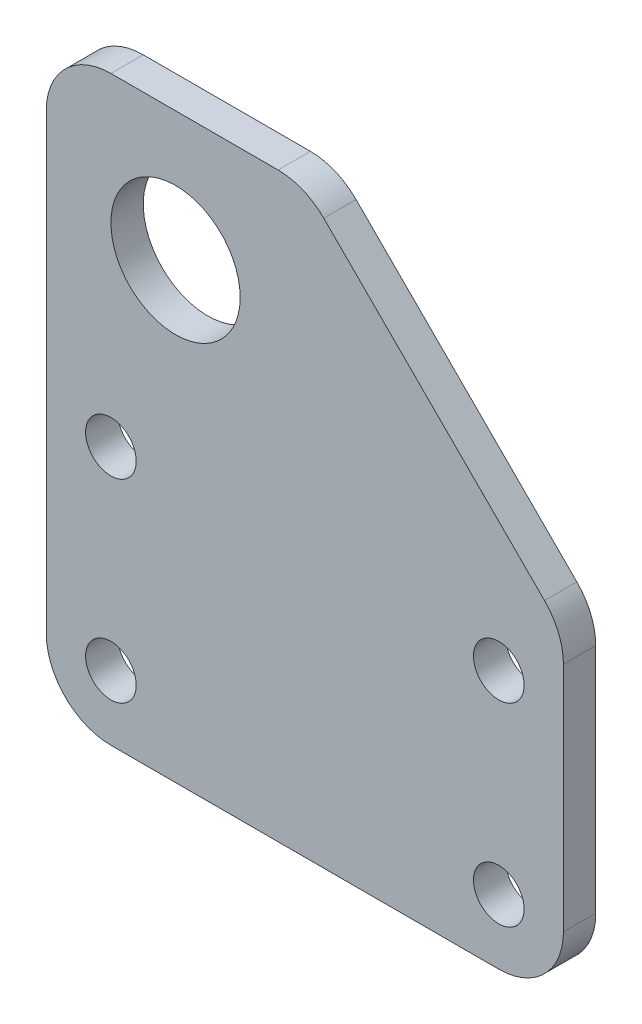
SolidWorks part; units mm, degrees
ref_plane "Front" through (0, 0, 0) normal (0, 0, 1) x (1, 0, 0)
ref_plane "Top" through (0, 0, 0) normal (0, 1, 0) x (1, 0, 0)
ref_plane "Right" through (0, 0, 0) normal (1, 0, 0) x (0, 0, -1)
sketch "Sketch1" plane through (0, 0, 0) normal (0, 0, 1) x (1, 0, 0)
  line L0 (50.8, 0) -> (0, 0)
  line L1 (0, 0) -> (0, 57.15)
  line L2 (0, 57.15) -> (25.4, 57.15)
  line L3 (50.8, 0) -> (50.8, 31.75)
  line L4 (50.8, 31.75) -> (25.4, 57.15)
  line L5 (25.4, 0) -> (25.4, 57.15) construction
  line L6 (44.45, 6.35) -> (6.35, 6.35) construction
  line L7 (44.45, 6.35) -> (44.45, 25.4) construction
  line L8 (44.45, 25.4) -> (6.35, 25.4) construction
  line L9 (6.35, 6.35) -> (6.35, 25.4) construction
  line L10 (50.8, 15.875) -> (0, 15.875) construction
  line L11 (12.7, 57.15) -> (12.7, 44.45) construction
  line L12 (12.7, 44.45) -> (0, 44.45) construction
  circle A0 centre (6.35, 25.4) radius 2.4892
  circle A1 centre (44.45, 25.4) radius 2.4892
  circle A2 centre (44.45, 6.35) radius 2.4892
  circle A3 centre (6.35, 6.35) radius 2.4892
  circle A4 centre (12.7, 44.45) radius 6.35
  point P11 (25.4, 6.35)
  point P14 (44.45, 15.875)
  dimension "D7" = 4.9784
  dimension "D8" = 12.7
  dimension "D1" = 31.75
  dimension "D2" = 50.8
  dimension "D3" = 57.15
  dimension "D4" = 25.4
  dimension "D5" = 19.05
  dimension "D6" = 6.35
extrude "Boss-Extrude1" add sketch "Sketch1" along normal blind 3.175
fillet "Fillet1" radius 6.35 5 edges at (0, 57.15, 1.5875) (0, 0, 1.5875) (50.8, 0, 1.5875) (50.8, 31.75, 1.5875) (25.4, 57.15, 1.5875)
